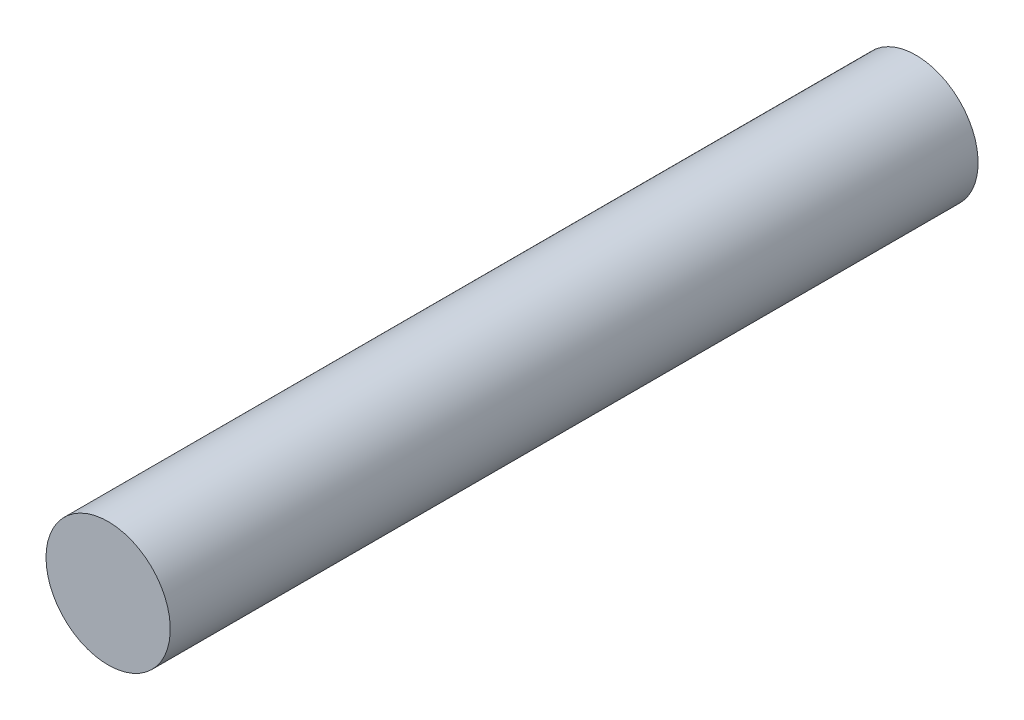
SolidWorks part; units mm, degrees
ref_plane "Face" through (0, 0, 0) normal (0, 0, 1) x (1, 0, 0)
ref_plane "Dessus" through (0, 0, 0) normal (0, 1, 0) x (1, 0, 0)
ref_plane "Droite" through (0, 0, 0) normal (1, 0, 0) x (0, 0, -1)
sketch "Esquisse1" plane through (0, 0, 0) normal (0, 0, 1) x (1, 0, 0)
  circle A0 centre (0, 0) radius 1
  dimension "D1" = 2
extrude "Extrusion1" add sketch "Esquisse1" along normal blind 13
